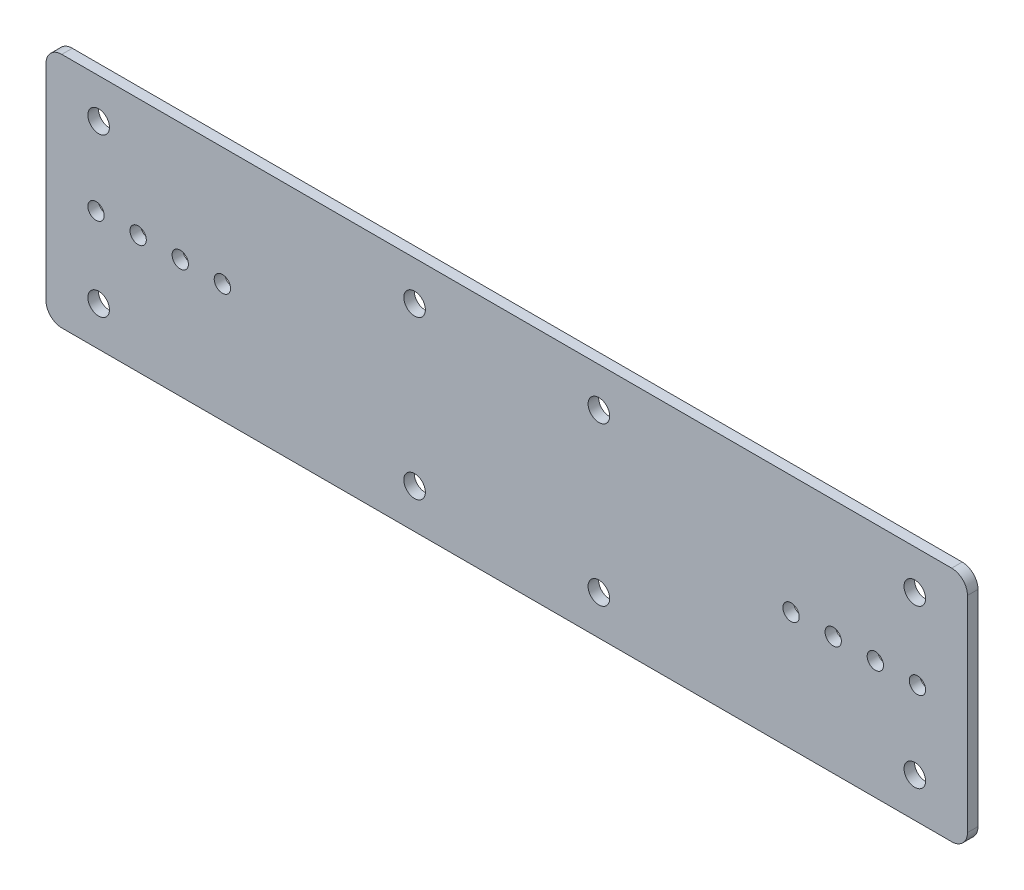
SolidWorks part; units mm, degrees
ref_plane "前视基准面" through (0, 0, 0) normal (0, 0, 1) x (1, 0, 0)
ref_plane "上视基准面" through (0, 0, 0) normal (0, 1, 0) x (1, 0, 0)
ref_plane "右视基准面" through (0, 0, 0) normal (1, 0, 0) x (0, 0, -1)
sketch "草图1" plane through (0, 0, 0) normal (0, 0, 1) x (1, 0, 0)
  line L0 (0, 0) -> (0, 22.5) construction
  line L1 (-160, -22.5) -> (160, -22.5)
  line L2 (-160, -22.5) -> (-160, 22.5)
  line L3 (-160, 22.5) -> (160, 22.5)
  line L4 (160, -22.5) -> (160, 22.5)
  line L5 (-160, -22.5) -> (160, 22.5) construction
  line L6 (-160, 22.5) -> (160, -22.5) construction
  line L7 (0, 0) -> (-160, 0) construction
  circle A0 centre (-17.5, 15) radius 2.05
  circle A1 centre (17.5, 15) radius 2.05
  circle A2 centre (17.5, -15) radius 2.05
  circle A3 centre (-17.5, -15) radius 2.05
  circle A4 centre (-150.5, 15) radius 2.05
  circle A5 centre (-135.5, 15) radius 2.05
  circle A6 centre (-135.5, -15) radius 2.05
  circle A7 centre (-150.5, -15) radius 2.05
  circle A8 centre (150.5, 15) radius 2.05
  circle A9 centre (150.5, -15) radius 2.05
  circle A10 centre (135.5, -15) radius 2.05
  circle A11 centre (135.5, 15) radius 2.05
  circle A12 centre (-77.5, 15) radius 2.05
  circle A13 centre (-77.5, -15) radius 2.05
  circle A14 centre (77.5, -15) radius 2.05
  circle A15 centre (77.5, 15) radius 2.05
  point P0 (0, 0)
  dimension "D3" = 4.1
  dimension "D4" = 35
  dimension "D5" = 30
  dimension "D6" = 2
  dimension "D8" = 30
  dimension "D9" = 9.5
  dimension "D10" = 2
  dimension "D12" = 4.1
  dimension "D1" = 320
  dimension "D2" = 45
  dimension "D7" = 2
  dimension "D11" = 2
  dimension "D13" = 2
extrude "凸台-拉伸1" add sketch "草图1" along normal blind 2
sketch "草图2" [suppressed] plane through (0, 0, 3) normal (0, 0, 1) x (1, 0, 0)
  line L0 (-160, 0) -> (160, 0) construction
  line L1 (-160, 22.5) -> (-160, -22.5) construction
  line L2 (160, -22.5) -> (160, 22.5) construction
  line L3 (0, 0) -> (0, 58.1618) construction
  circle A0 centre (-90, 6) radius 1.6
  circle A1 centre (-19, 6) radius 1.6
  circle A2 centre (-19, -6) radius 1.6
  circle A3 centre (-90, -6) radius 1.6
  circle A4 centre (19, -6) radius 1.6
  circle A5 centre (19, 6) radius 1.6
  circle A6 centre (90, -6) radius 1.6
  circle A7 centre (90, 6) radius 1.6
  dimension "D1" = 3.2
  dimension "D2" = 70
  dimension "D3" = 12
  dimension "D4" = 2
  dimension "D5" = 2
sketch "草图3" plane through (0, 0, 2) normal (0, 0, 1) x (1, 0, 0)
  line L0 (160, 22.5) -> (-160, 22.5) construction
  line L1 (-87.5, 22.5) -> (87.5, 22.5)
  line L2 (-87.5, 22.5) -> (-87.5, -22.5)
  line L3 (-87.5, -22.5) -> (87.5, -22.5)
  line L4 (87.5, 22.5) -> (87.5, -22.5)
  line L5 (-160, -22.5) -> (160, -22.5) construction
  line L7 (-181.2579, 54.7615) -> (175.3372, 54.7615)
  line L8 (-181.2579, 54.7615) -> (-181.2579, -52.5833)
  line L9 (-181.2579, -52.5833) -> (175.3372, -52.5833)
  line L10 (175.3372, 54.7615) -> (175.3372, -52.5833)
  circle A0 centre (-77.5, 15) radius 2.05 construction
  circle A1 centre (77.5, 15) radius 2.05 construction
  dimension "D1" = 10
  dimension "D2" = 10
extrude "切除-拉伸1" cut sketch "草图3" against normal blind 10
sketch "草图4" plane through (0, 0, 2) normal (0, 0, 1) x (1, 0, 0)
  circle A0 centre (-78, 0) radius 1.55 construction
  circle A1 centre (-70, 0) radius 1.55 construction
  circle A2 centre (-62, 0) radius 1.55 construction
  circle A3 centre (-54, 0) radius 1.55 construction
  circle A4 centre (54, 0) radius 1.55 construction
  circle A5 centre (62, 0) radius 1.55 construction
  circle A6 centre (70, 0) radius 1.55 construction
  circle A7 centre (78, 0) radius 1.55 construction
  circle A8 centre (-78, 0) radius 1.55
  circle A9 centre (-70, 0) radius 1.55
  circle A10 centre (-62, 0) radius 1.55
  circle A11 centre (-54, 0) radius 1.55
  circle A12 centre (54, 0) radius 1.55
  circle A13 centre (62, 0) radius 1.55
  circle A14 centre (70, 0) radius 1.55
  circle A15 centre (78, 0) radius 1.55
extrude "切除-拉伸2" cut sketch "草图4" against normal blind 10
fillet "圆角1" radius 3 4 edges at (-87.5, 22.5, 1) (-87.5, -22.5, 1) (87.5, -22.5, 1) (87.5, 22.5, 1)
